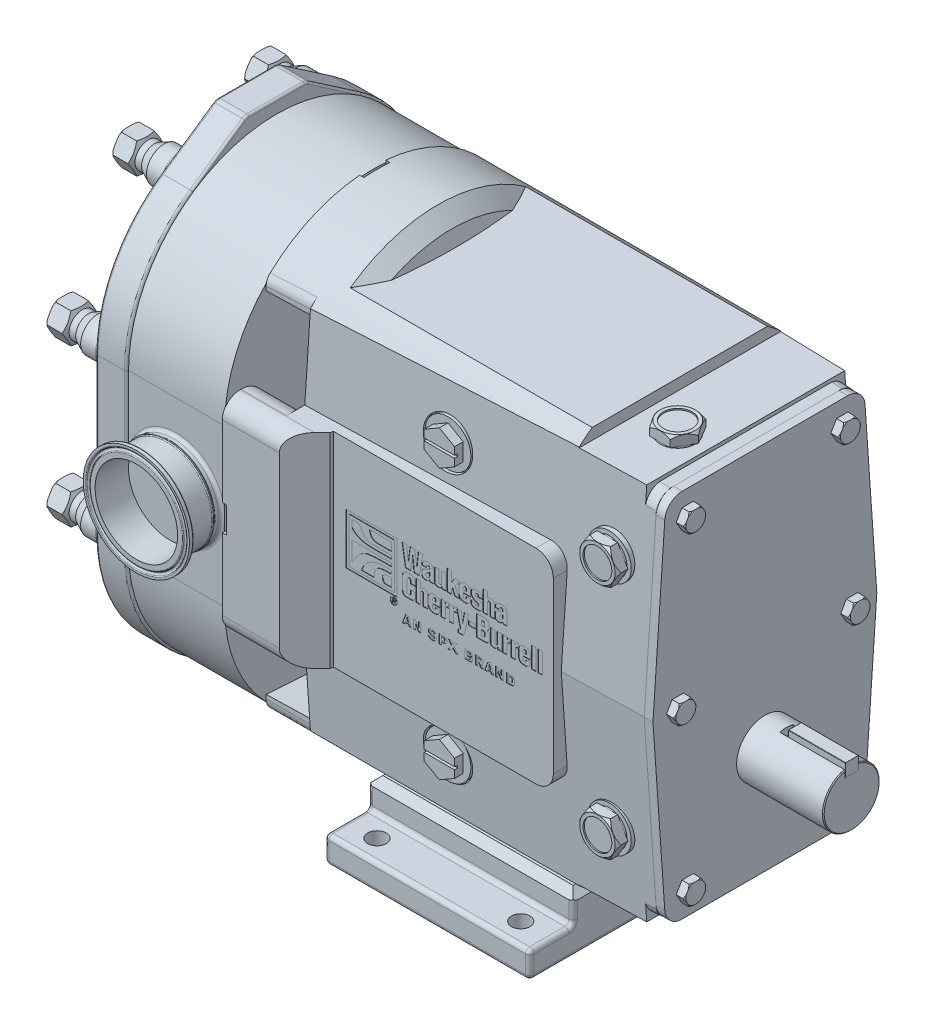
SolidWorks part; units mm, degrees
ref_plane "Front Plane" through (0, 0, 0) normal (0, 0, 1) x (1, 0, 0)
ref_plane "Top Plane" through (0, 0, 0) normal (0, 1, 0) x (1, 0, 0)
ref_plane "Right Plane" through (0, 0, 0) normal (1, 0, 0) x (0, 0, -1)
other "Join1"
other "grease fitting<4>@060_U2_Lower Shaft"
other "grease fitting<2>@060_U2_Lower Shaft"
other "cleanout plug<2>@060_U2_Lower Shaft"
other "oil plug<4>@060_U2_Lower Shaft"
other "oil plug<2>@060_U2_Lower Shaft"
other "108371<8>@060_U2_Lower Shaft"
other "108371<7>@060_U2_Lower Shaft"
other "108371<6>@060_U2_Lower Shaft"
other "108371<4>@060_U2_Lower Shaft"
other "108371<3>@060_U2_Lower Shaft"
other "108371<2>@060_U2_Lower Shaft"
other "Key_060<1>@060_U2_Lower Shaft"
other "grease fitting<3>@060_U2_Lower Shaft"
other "grease fitting<1>@060_U2_Lower Shaft"
other "oil plug<6>@060_U2_Lower Shaft"
other "oil plug<5>@060_U2_Lower Shaft"
other "cleanout plug<1>@060_U2_Lower Shaft"
other "oil plug<3>@060_U2_Lower Shaft"
other "oil plug<1>@060_U2_Lower Shaft"
other "Shaft_060<1>@060_U2_Lower Shaft"
other "plate_060<1>@060_U2_Lower Shaft"
other "108371<5>@060_U2_Lower Shaft"
other "108371<1>@060_U2_Lower Shaft"
other "101848<1>@060_U2_Lower Shaft"
other "101867<1>@060_U2_Lower Shaft"
other "070110000<1>@060_U2_Lower Shaft"
other "070005000<1>@060_U2_Lower Shaft"
other "060360007<2>@060_U2_Lower Shaft"
other "060360007<1>@060_U2_Lower Shaft"
